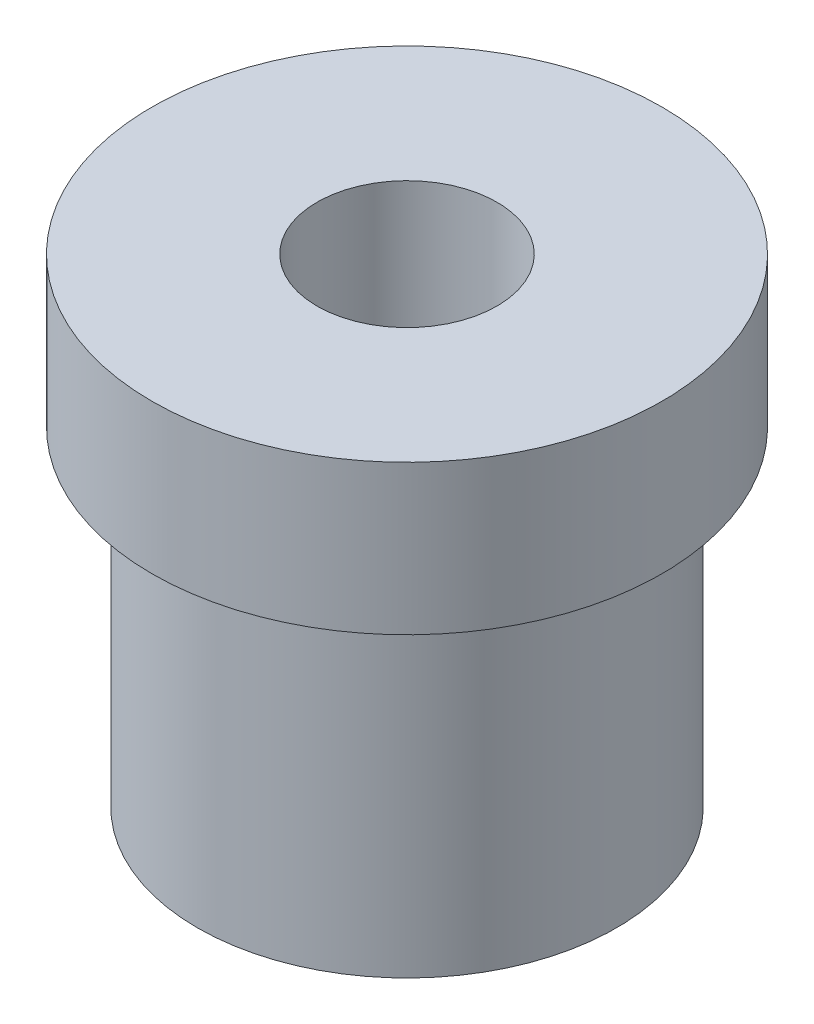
SolidWorks part; units mm, degrees
ref_plane "Plane1" through (0, 0, 0) normal (0, 0, 1) x (1, 0, 0)
ref_plane "Plane2" through (0, 0, 0) normal (0, 1, 0) x (1, 0, 0)
ref_plane "Plane3" through (0, 0, 0) normal (1, 0, 0) x (0, 0, -1)
extrude "Base-Extrude" add sketch "Sketch1" against normal blind 12.7
sketch "Sketch1" plane through (0, 0, 0) normal (0, 1, 0) x (1, 0, 0)
  circle A0 centre (0, 0) radius 5.5562
  dimension "D1" = 11.1125
extrude "Boss-Extrude1" add sketch "Sketch2" against normal blind 3.9624
sketch "Sketch2" plane through (0, 0, 0) normal (0, 1, 0) x (-1, 0, 0)
  circle A0 centre (0, 0) radius 6.7627
  dimension "D1" = 13.5255
sketch "Sketch3" plane through (0, 0, 0) normal (0, 1, 0) x (-1, 0, 0)
  circle A0 centre (0, 0) radius 2.3876
  dimension "D1" = 4.7752
extrude "Cut-Extrude1" cut sketch "Sketch3" against normal through all
